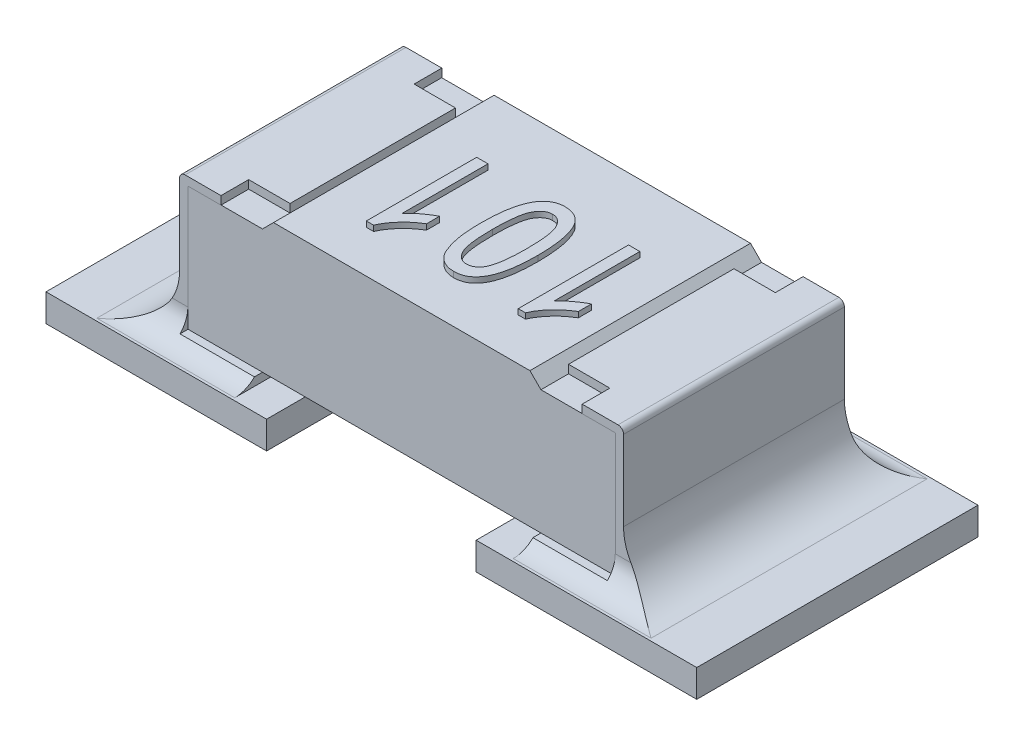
SolidWorks part; units mm, degrees
ref_plane "Plan de face" through (0, 0, 0) normal (0, 0, 1) x (1, 0, 0)
ref_plane "Plan de dessus" through (0, 0, 0) normal (0, 1, 0) x (1, 0, 0)
ref_plane "Plan de droite" through (0, 0, 0) normal (1, 0, 0) x (0, 0, -1)
sketch "Esquisse1" plane through (0, 0, 0) normal (1, 0, 0) x (0, 0, -1)
  line L1 (-0.4, 0.58) -> (0.4, 0.58)
  line L2 (-0.4, 0.58) -> (-0.4, 0.13)
  line L3 (-0.4, 0.13) -> (0.4, 0.13)
  line L4 (0.4, 0.58) -> (0.4, 0.13)
  dimension "D1" = 0.13
  dimension "D2" = 0.4
  dimension "D3" = 0.8
  dimension "D4" = 0.45
extrude "Extrusion1" add sketch "Esquisse1" along normal mid plane 1.55
sketch "Esquisse2" plane through (0, 0, 0) normal (0, 0, 1) x (1, 0, 0)
  line L4 (-0.505, 0.61) -> (-0.505, 0.58)
  line L5 (0.775, 0.58) -> (-0.775, 0.58) construction
  line L6 (-0.505, 0.13) -> (-0.505, 0.1)
  line L7 (0.775, 0.13) -> (-0.775, 0.13) construction
  line L8 (-0.805, 0.61) -> (-0.805, 0.1)
  line L9 (-0.805, 0.1) -> (0.805, 0.1)
  line L10 (0.805, 0.1) -> (0.805, 0.61)
  line L11 (0.805, 0.61) -> (-0.805, 0.61)
  line L12 (-0.805, 0.59) -> (-0.805, 0.1)
  line L13 (0.505, 0.61) -> (0.785, 0.61)
  line L14 (0.805, 0.1) -> (0.805, 0.59)
  line L15 (0.505, 0.1) -> (0.805, 0.1)
  line L16 (0.505, 0.61) -> (0.505, 0.58)
  line L17 (0.505, 0.13) -> (0.505, 0.1)
  line L18 (0.505, 0.13) -> (0.775, 0.13)
  line L19 (0.775, 0.13) -> (0.775, 0.58)
  line L20 (0.775, 0.58) -> (0.505, 0.58)
  line L21 (-0.505, 0.1) -> (-0.805, 0.1)
  line L22 (-0.505, 0.13) -> (-0.775, 0.13)
  line L23 (-0.775, 0.13) -> (-0.775, 0.58)
  line L24 (-0.775, 0.58) -> (-0.505, 0.58)
  line L26 (-0.785, 0.61) -> (-0.505, 0.61)
  arc A0 (0.805, 0.59) -> (0.785, 0.61) centre (0.785, 0.59) ccw
  arc A1 (-0.785, 0.61) -> (-0.805, 0.59) centre (-0.785, 0.59) ccw
  dimension "D4" = 0.02
  dimension "D2" = 0.3
  dimension "D3" = 0.3
  dimension "D1" = 0.03
extrude "Extrusion2" add sketch "Esquisse2" along normal mid plane 0.801
sketch "Esquisse3" plane through (0, 0.61, 0) normal (0, 1, 0) x (-1, 0, 0)
  line L0 (0.505, 0.4005) -> (0.505, -0.4005) construction
  line L1 (0.505, -0.5) -> (0.655, -0.5)
  line L2 (0.505, -0.5) -> (0.505, -0.3)
  line L3 (0.505, -0.3) -> (0.655, -0.3)
  line L4 (0.655, -0.5) -> (0.655, -0.3)
  line L5 (0, 0) -> (0, 0.6053) construction
  line L6 (-0.655, -0.5) -> (-0.655, -0.3)
  line L7 (-0.505, -0.3) -> (-0.655, -0.3)
  line L8 (-0.505, -0.5) -> (-0.505, -0.3)
  line L9 (-0.505, -0.5) -> (-0.655, -0.5)
  line L10 (0, 0) -> (0.2891, 0) construction
  line L11 (-0.505, 0.5) -> (-0.655, 0.5)
  line L12 (-0.505, 0.5) -> (-0.505, 0.3)
  line L13 (-0.505, 0.3) -> (-0.655, 0.3)
  line L14 (-0.655, 0.5) -> (-0.655, 0.3)
  line L15 (0.655, 0.5) -> (0.655, 0.3)
  line L16 (0.505, 0.3) -> (0.655, 0.3)
  line L17 (0.505, 0.5) -> (0.505, 0.3)
  line L18 (0.505, 0.5) -> (0.655, 0.5)
  dimension "D1" = 0.15
  dimension "D2" = 0.2
  dimension "D3" = 0.3
extrude "Enlèv. mat.-Extru.4" cut sketch "Esquisse3" against normal blind 0.03
sketch "Esquisse4" plane through (0, 0, 0) normal (0, 0, 1) x (1, 0, 0)
  line L0 (-0.505, 0.58) -> (-0.465, 0.62)
  line L1 (-0.465, 0.62) -> (0.465, 0.62)
  line L2 (0.465, 0.62) -> (0.505, 0.58)
  line L4 (0.505, 0.58) -> (-0.505, 0.58)
  line L8 (0.505, 0.61) -> (0.655, 0.61) construction
  point P3 (0.58, 0.61)
  dimension "D1" = 45
  dimension "D2" = 45
  dimension "D3" = 0.01
extrude "Extrusion5" add sketch "Esquisse4" along normal mid plane 0.8
sketch "Esquisse5" plane through (0, 0, 0) normal (0, 1, 0) x (1, 0, 0)
  line L0 (0, 0) -> (0, -0.6254) construction
  line L1 (-1.18, 0.51) -> (-0.38, 0.51)
  line L2 (-1.18, 0.51) -> (-1.18, -0.51)
  line L3 (-1.18, -0.51) -> (-0.38, -0.51)
  line L4 (-0.38, 0.51) -> (-0.38, -0.51)
  line L5 (0.38, 0.51) -> (0.38, -0.51)
  line L6 (1.18, -0.51) -> (0.38, -0.51)
  line L7 (1.18, 0.51) -> (1.18, -0.51)
  line L8 (1.18, 0.51) -> (0.38, 0.51)
  dimension "D1" = 0.38
  dimension "D2" = 1.02
  dimension "D3" = 0.51
  dimension "D4" = 0.8
extrude "Extrusion4" add sketch "Esquisse5" along normal blind 0.1
fillet "Congé1" radius 0.2 2 edges at (-0.805, 0.1, 0) (0.805, 0.1, 0)
fillet "Congé2" radius 0.1 12 edges at (-0.64, 0.13, -0.4005) (-0.755, 0.1, -0.4005) (-0.505, 0.115, -0.4005) (-0.755, 0.1, 0.4005) (-0.505, 0.115, 0.4005) (-0.64, 0.13, 0.4005) (0.64, 0.13, -0.4005) (0.755, 0.1, -0.4005) (0.505, 0.115, -0.4005) (0.755, 0.1, 0.4005) (0.64, 0.13, 0.4005) (0.505, 0.115, 0.4005)
sketch "Esquisse6" plane through (0, 0.62, 0) normal (0, 1, 0) x (-1, 0, 0)
  line L1 (-0.4332, -0.1535) -> (0.3855, -0.1535) construction
  text T0 "101" font "Arial" height 0.4
extrude "Extrusion6" add sketch "Esquisse6" along normal blind 0.02
